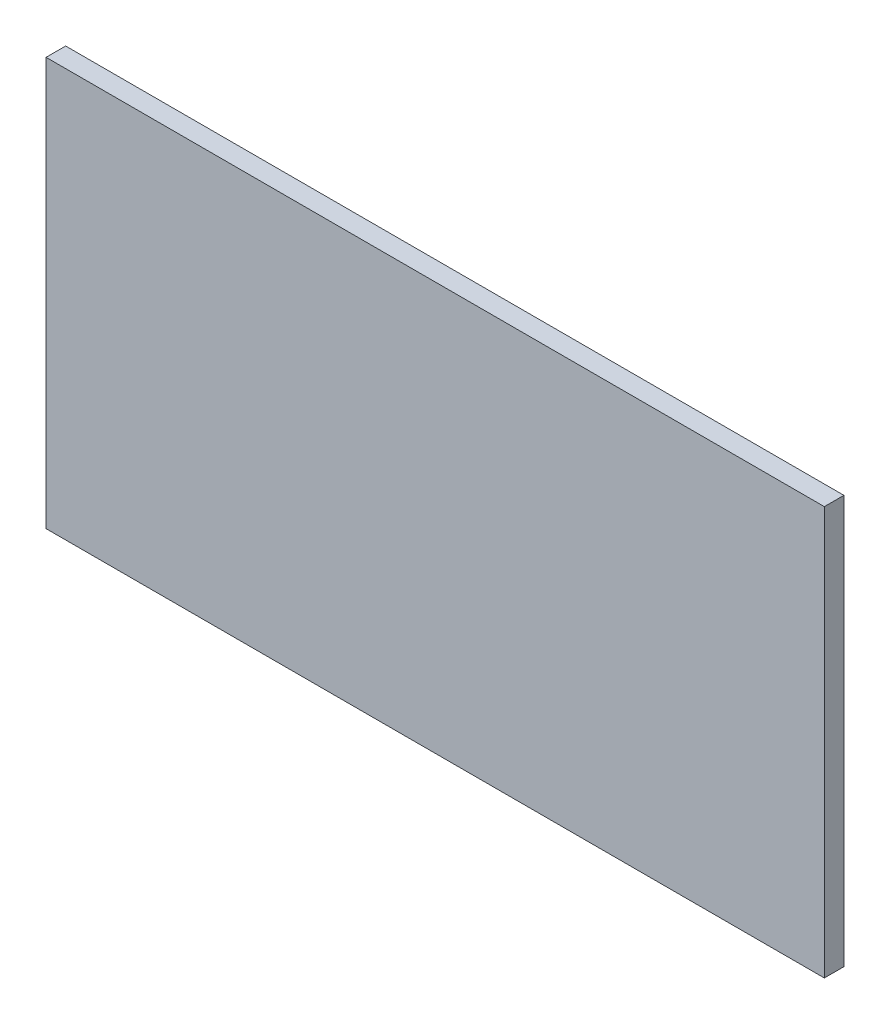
SolidWorks part; units mm, degrees
ref_plane "Спереди" through (0, 0, 0) normal (0, 0, 1) x (1, 0, 0)
ref_plane "Сверху" through (0, 0, 0) normal (0, 1, 0) x (1, 0, 0)
ref_plane "Справа" through (0, 0, 0) normal (1, 0, 0) x (0, 0, -1)
sketch "Эскиз1" plane through (0, 0, 0) normal (0, 0, 1) x (1, 0, 0)
  line L1 (39.75, -20.85) -> (-39.75, -20.85)
  line L2 (39.75, -20.85) -> (39.75, 20.85)
  line L3 (39.75, 20.85) -> (-39.75, 20.85)
  line L4 (-39.75, -20.85) -> (-39.75, 20.85)
  line L5 (39.75, -20.85) -> (-39.75, 20.85) construction
  line L6 (39.75, 20.85) -> (-39.75, -20.85) construction
  line L8 (-40, -21.1) -> (-1.2, -21.1) construction
  line L10 (1.2, 21.1) -> (40, 21.1) construction
  line L12 (40, -33.15) -> (40, 33.15) construction
  line L13 (-40, 33.15) -> (-40, -33.15) construction
  point P0 (0, 0)
  dimension "D1" = 0.25
  dimension "D2" = 0.25
  dimension "D3" = 0.25
  dimension "D4" = 0.25
extrude "Бобышка-Вытянуть1" add sketch "Эскиз1" along normal blind 2
